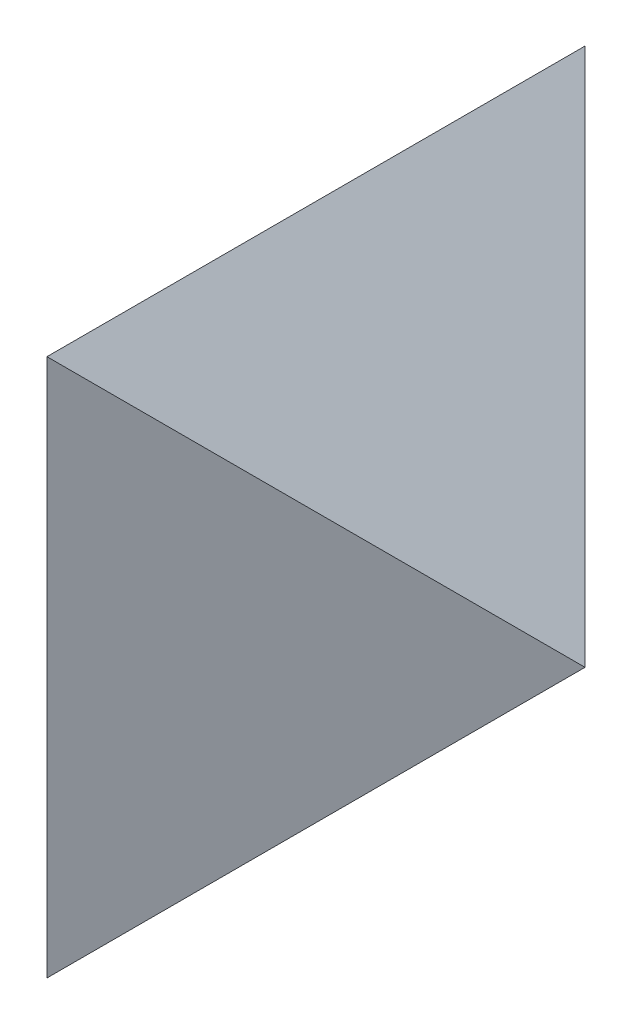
SolidWorks part; units mm, degrees
ref_plane "Front Plane" through (0, 0, 0) normal (0, 0, 1) x (1, 0, 0)
ref_plane "Top Plane" through (0, 0, 0) normal (0, 1, 0) x (1, 0, 0)
ref_plane "Right Plane" through (0, 0, 0) normal (1, 0, 0) x (0, 0, -1)
sketch "Sketch1" plane through (0, 0, 0) normal (0, 1, 0) x (1, 0, 0)
  line L1 (0, 0) -> (162.5, 0)
  line L2 (0, 0) -> (0, 115)
  line L3 (0, 115) -> (162.5, 115)
  line L4 (162.5, 0) -> (162.5, 115)
  dimension "D1" = 115
  dimension "D2" = 162.5
extrude "Boss-Extrude1" add sketch "Sketch1" along normal blind 2
sketch "Sketch2" plane through (0, 2, 0) normal (0, 1, 0) x (1, 0, 0)
  line L3 (162.5, 110) -> (39, 110)
  line L4 (5, 110) -> (5, 5)
  line L5 (5, 5) -> (162.5, 5)
  line L7 (0, 115) -> (0, 0) construction
  line L8 (162.5, 115) -> (0, 115) construction
  line L10 (162.5, 0) -> (162.5, 115) construction
  line L11 (0, 0) -> (162.5, 0) construction
  line L12 (0, 115) -> (39, 115) construction
  line L13 (39, 115) -> (39, 104.6994) construction
  line L14 (19, 115) -> (19, 104.6994) construction
  line L15 (19, 110) -> (5, 110)
  dimension "D1" = 5
  dimension "D2" = 5
  dimension "D3" = 5
  dimension "D4" = 39
  dimension "D5" = 20
  dimension "D6" = 10.3006
extrude "Extrude-Thin1" add sketch "Sketch2" along normal blind 8 thin
fillet "Fillet1" radius 10 2 edges at (0, 5, -115) (0, 5, 0)
sketch "Sketch3" plane through (162.5, 0, 0) normal (1, 0, 0) x (0, 0, -1)
  line L0 (10, 10) -> (0, 10) construction
  line L5 (2, 8) -> (8, 8)
  line L6 (2, 8) -> (2, 2)
  line L7 (2, 2) -> (8, 2)
  line L8 (8, 8) -> (8, 2)
  line L9 (107, 8) -> (113, 8)
  line L10 (107, 8) -> (107, 2)
  line L11 (107, 2) -> (113, 2)
  line L12 (113, 8) -> (113, 2)
  line L13 (0, 10) -> (0, 0) construction
  line L14 (0, 0) -> (115, 0) construction
  line L15 (10, 10) -> (10, 2) construction
  line L16 (115, 10) -> (115, 0) construction
  line L17 (105, 10) -> (105, 2) construction
  dimension "D1" = 2
  dimension "D2" = 2
  dimension "D3" = 2
  dimension "D4" = 2
  dimension "D5" = 2
  dimension "D6" = 2
extrude "Cut-Extrude1" cut sketch "Sketch3" against normal blind 10 draft 45
sketch "Sketch4" plane through (162.5, 0, 0) normal (1, 0, 0) x (0, 0, -1)
  line L0 (0, 0) -> (115, 0) construction
  line L1 (0, 10) -> (10, 10)
  line L2 (0, 10) -> (0, 0)
  line L3 (0, 0) -> (10, 0)
  line L4 (10, 10) -> (10, 0)
  dimension "D1" = 10
extrude "Boss-Extrude2" add sketch "Sketch4" against normal blind 20 separate body
combine bodies "Combine1" operation type subtract main body 104 bodies to subtract 103
mirror "Mirror1" about plane through (162.5, 0, 0) normal (1, 0, 0)
scale "Scale1" bodies to scale 106 scale about centroid uniform scaling yes scale factor 0.95
